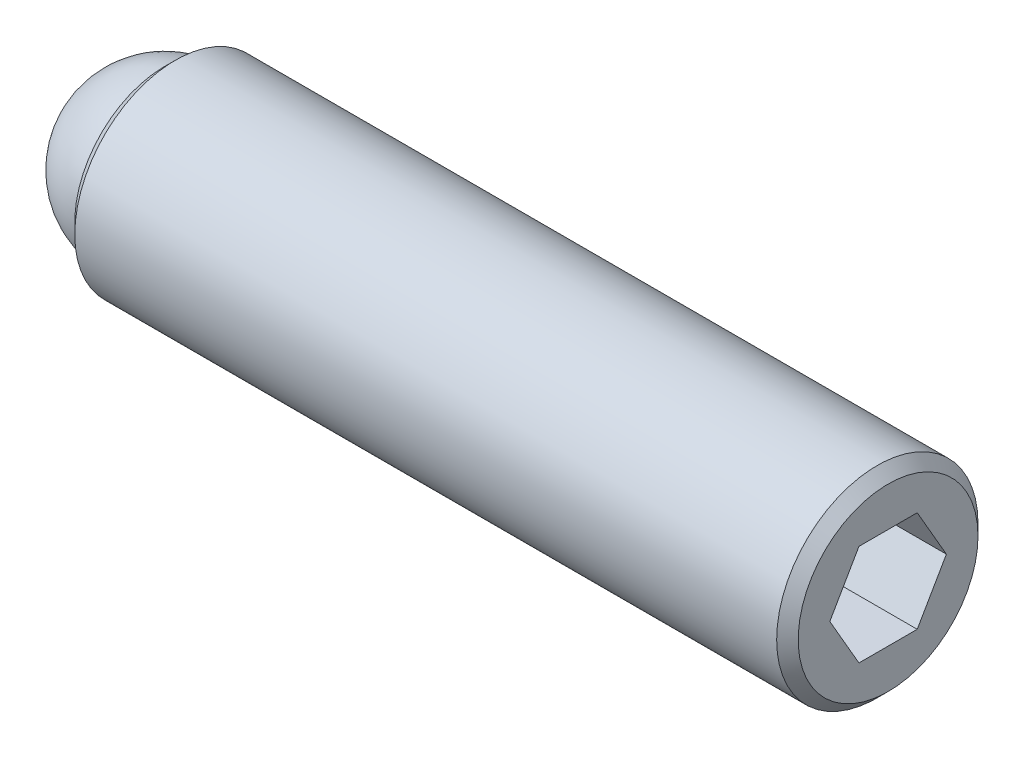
SolidWorks part; units mm, degrees
ref_plane "Front Plane" through (0, 0, 0) normal (0, 0, 1) x (1, 0, 0)
ref_plane "Top Plane" through (0, 0, 0) normal (0, 1, 0) x (1, 0, 0)
ref_plane "Right Plane" through (0, 0, 0) normal (1, 0, 0) x (0, 0, -1)
sketch "Sketch2" plane through (0, 0, 0) normal (1, 0, 0) x (0, 0, -1)
  circle A0 centre (0, 0) radius 2.3749
  dimension "D1" = 4.7498
extrude "Boss-Extrude1" add sketch "Sketch2" along normal blind 17.0656
sketch "Sketch3" plane through (0, 0, 0) normal (-1, 0, 0) x (0, 0, 1)
  circle A0 centre (0, 0) radius 1.9812
  dimension "D1" = 3.9624
chamfer "Chamfer1" distance 0.254 angle 45 1 edges at (0, 0, -2.3749)
chamfer "Chamfer2" distance 0.254 angle 45 1 edges at (17.0656, 0, -2.3749)
sketch "Sketch4" plane through (17.0656, 0, 0) normal (1, 0, 0) x (0, 0, -1)
  line L1 (1.3748, 0) -> (0.6874, 1.1906)
  line L2 (0.6874, 1.1906) -> (-0.6874, 1.1906)
  line L3 (-0.6874, 1.1906) -> (-1.3748, 0)
  line L4 (-1.3748, 0) -> (-0.6874, -1.1906)
  line L5 (-0.6874, -1.1906) -> (0.6874, -1.1906)
  line L6 (0.6874, -1.1906) -> (1.3748, 0)
  circle A0 centre (0, 0) radius 1.1906 construction
  dimension "D1" = 2.3813
extrude "Cut-Extrude2" cut sketch "Sketch4" against normal blind 2.286
extrude "Cut-Extrude3" cut sketch "Sketch3" against normal blind 1.9844
sketch "Sketch5" plane through (0, 0, 0) normal (-1, 0, 0) x (0, 0, 1)
  line L0 (0, 0) -> (0, -1.9844)
  line L1 (0, 0) -> (0, 1.9844)
  arc A0 (0, 1.9844) -> (0, -1.9844) centre (0, 0) ccw
  dimension "D1" = 1.9844
revolve "Revolve1" add sketch "Sketch5" angle 360 about L1
